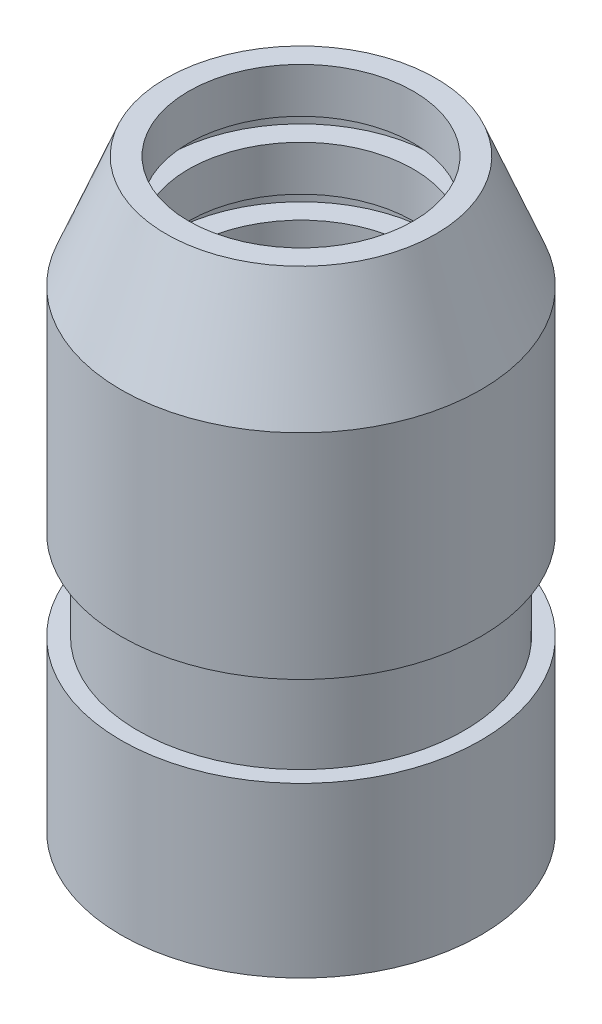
SolidWorks part; units mm, degrees
ref_plane "Face" through (0, 0, 0) normal (0, 0, 1) x (1, 0, 0)
ref_plane "Dessus" through (0, 0, 0) normal (0, 1, 0) x (1, 0, 0)
ref_plane "Droite" through (0, 0, 0) normal (1, 0, 0) x (0, 0, -1)
sketch "Esquisse1" plane through (0, 0, 0) normal (0, 0, 1) x (1, 0, 0)
  line L0 (0, 37.7237) -> (0, -23.8917) construction
  line L1 (6.5, 0) -> (6.5, 4.5)
  line L2 (5, 16) -> (6, 16)
  line L3 (6, 16) -> (6, 17)
  line L4 (6, 17) -> (5, 17)
  line L5 (5, 17) -> (5, 19)
  line L6 (5, 19) -> (6, 19)
  line L7 (6, 19) -> (6, 20)
  line L8 (6, 20) -> (5, 20)
  line L9 (5, 20) -> (5, 22)
  line L10 (5, 22) -> (6, 22)
  line L11 (6, 22) -> (8, 17)
  line L14 (8, 17) -> (8, 7.5)
  line L15 (8, 7.5) -> (7.25, 7.5)
  line L16 (7.25, 7.5) -> (7.25, 3.5)
  line L17 (7.25, 3.5) -> (8, 3.5)
  line L18 (8, 3.5) -> (8, -4)
  line L19 (8, -4) -> (7.5, -4)
  line L20 (7.5, -4) -> (7.5, 0)
  line L21 (7.5, 0) -> (6.5, 0)
  line L22 (6.5, 4.5) -> (5, 4.5)
  line L23 (5, 4.5) -> (5, 16)
  dimension "D1" = 5
  dimension "D2" = 1
  dimension "D3" = 2
  dimension "D4" = 1
  dimension "D5" = 1
  dimension "D6" = 2
  dimension "D7" = 1
  dimension "D8" = 6.5
  dimension "D9" = 7.5
  dimension "D10" = 4.5
  dimension "D11" = 8
  dimension "D12" = 4
  dimension "D13" = 26
  dimension "D14" = 7.5
  dimension "D15" = 4
  dimension "D16" = 5
  dimension "D17" = 7.25
revolve "Révolution1" add sketch "Esquisse1" angle 360 about L0
